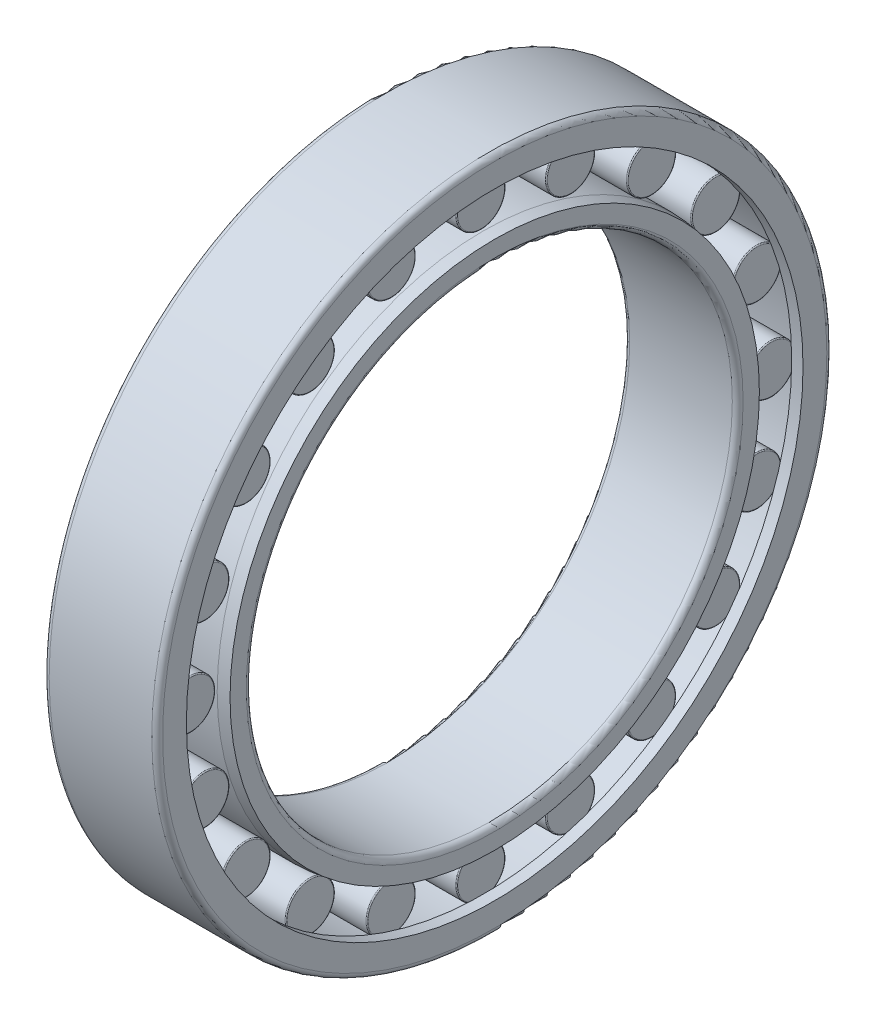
SolidWorks part; units mm, degrees
ref_plane "Plane1" through (0, 0, 0) normal (0, 0, 1) x (1, 0, 0)
ref_plane "Plane2" through (0, 0, 0) normal (0, 1, 0) x (1, 0, 0)
ref_plane "Plane3" through (0, 0, 0) normal (1, 0, 0) x (0, 0, -1)
sketch "Clipboard" plane through (0, 0, 0) normal (0, 0, 1) x (1, 0, 0)
  line L0 (-10, 0) -> (10, 0) construction
  line L1 (0, 0) -> (185.2698, -67.4327)
  line L2 (0, 0) -> (101.017, 36.7672)
  line L3 (0, 0) -> (218.798, -79.636)
  line L4 (0, 0) -> (-22.3471, -0.7804)
  dimension "CLdia" = 107.5
  dimension "Count" = 20
  dimension "Show_count" = 20
  dimension "Max_count" = 20
  dimension "Min_count" = 2
  dimension "Race_OD" = 232.84
  dimension "Race_ID" = 197.16
sketch "OutRacSke" plane through (0, 0, 0) normal (0, 0, 1) x (1, 0, 0)
  line L0 (-16.8, 114.1887) -> (-21, 114.1887)
  line L1 (-21, 114.1887) -> (-21, 123)
  line L2 (-19, 125) -> (19, 125)
  line L3 (21, 123) -> (21, 114.1888)
  line L4 (21, 114.1888) -> (16.8, 114.1888)
  line L5 (16.8, 114.1888) -> (16.8, 116.42)
  line L6 (16.8, 116.42) -> (-16.8, 116.42)
  line L7 (-16.8, 116.42) -> (-16.8, 114.1887)
  line L8 (-90, 0) -> (90, 0) construction
  arc A0 (-21, 123) -> (-19, 125) centre (-19, 123) cw
  arc A1 (19, 125) -> (21, 123) centre (19, 123) cw
  dimension "radius" = 2
  dimension "Race_OD" = 232.84
  dimension "OD" = 250
  dimension "Cyl_Len" = 33.6
  dimension "halfCylLen" = 16.8
  dimension "Width" = 42
  dimension "halfWidth" = 21
  dimension "groove_dp" = 2.2313
revolve "OuterRace" add sketch "OutRacSke" angle 360 about L8
sketch "RolDetSke" plane through (0, 0, 0) normal (0, 0, 1) x (1, 0, 0)
  line L0 (-15.96, 116.1851) -> (-15.96, 107.5)
  line L1 (-15.96, 107.5) -> (15.96, 107.5)
  line L2 (15.96, 107.5) -> (15.96, 116.1851)
  line L3 (15.5981, 116.547) -> (-15.5981, 116.547)
  line L4 (-33.6, 107.5) -> (33.6, 107.5) construction
  arc A0 (15.96, 116.1851) -> (15.5981, 116.547) centre (15.5981, 116.1851) ccw
  arc A1 (-15.5981, 116.547) -> (-15.96, 116.1851) centre (-15.5981, 116.1851) ccw
  dimension "radius" = 0.3619
  dimension "RolCLRad" = 107.5
  dimension "Length" = 31.92
  dimension "halfLength" = 15.96
  dimension "Roller_diameter" = 18.094
revolve "RollerDetailed" add sketch "RolDetSke" angle 360 about L4
ref_axis "Axis1" through (-50, 0, 0) along (1, 0, 0)
sketch "RolSimSke" plane through (0, 101.6, 0) normal (0, 0, 1) x (1, 0, 0)
  line L0 (-15.96, 14.5851) -> (-15.96, -2.7851)
  line L1 (25.4, -101.6) -> (-25.4, -101.6) construction
  line L2 (15.96, -2.7851) -> (15.96, 14.5851)
  line L3 (15.5981, 14.947) -> (-15.5981, 14.947)
  line L5 (15.5981, -3.147) -> (-15.5981, -3.147)
  arc A0 (15.96, 14.5851) -> (15.5981, 14.947) centre (15.5981, 14.5851) ccw
  arc A1 (-15.5981, 14.947) -> (-15.96, 14.5851) centre (-15.5981, 14.5851) ccw
  arc A2 (15.96, -2.7851) -> (15.5981, -3.147) centre (15.5981, -2.7851) cw
  arc A3 (-15.5981, -3.147) -> (-15.96, -2.7851) centre (-15.5981, -2.7851) cw
  dimension "radius" = 0.3619
  dimension "D1" = 98.453
  dimension "Roller_diameter" = 18.094
  dimension "Rol_Length" = 31.92
  dimension "halfLength" = 15.96
revolve "RollersSimplified" [suppressed] add sketch "RolSimSke" angle 360 about L1
sketch "InsRacSke" plane through (0, 0, 0) normal (0, 0, 1) x (1, 0, 0)
  line L0 (-16.8, 98.58) -> (-21, 98.0222)
  line L1 (-21, 98.0222) -> (-21, 92)
  line L2 (-19, 90) -> (19, 90)
  line L3 (21, 92) -> (21, 98.0222)
  line L4 (21, 98.0222) -> (16.8, 98.58)
  line L5 (16.8, 98.58) -> (-16.8, 98.58)
  line L6 (-90, 0) -> (90, 0) construction
  arc A0 (-21, 92) -> (-19, 90) centre (-19, 92) ccw
  arc A1 (19, 90) -> (21, 92) centre (19, 92) ccw
  dimension "radius" = 2
  dimension "Bore" = 180
  dimension "Race_ID" = 197.16
  dimension "Width" = 42
  dimension "halfWidth" = 21
  dimension "groove_dp" = 0.5578
  dimension "Cyl_Len" = 33.6
revolve "InnerRace" add sketch "InsRacSke" angle 360 about L6
pattern_circular "RollersDetailed" count 20 every 18 about axis through (-50, 0, 0) along (1, 0, 0) of "RollerDetailed"
sketch "CagSpiSke" plane through (0, 0, 0) normal (0, 0, 1) x (1, 0, 0)
  line L0 (18.9, 105.2383) -> (18.9, 109.7618)
  line L1 (18.9, 109.7618) -> (-18.9, 109.7618)
  line L2 (-18.9, 109.7618) -> (-18.9, 105.2383)
  line L3 (-18.9, 105.2383) -> (18.9, 105.2383)
  line L4 (-90, 0) -> (90, 0) construction
  dimension "Cag_IR" = 210.4765
  dimension "thickness" = 4.5235
  dimension "width" = 37.8
  dimension "halfwidth" = 18.9
revolve "CageSpine" [suppressed] add sketch "CagSpiSke" angle 360 about L4
equation "\"CLdia@Clipboard\" =  ( \"Race_OD@Clipboard\" + \"Race_ID@Clipboard\" )  / 4"
equation "\"Race_OD@OutRacSke\" = \"Race_OD@Clipboard\""
equation "\"halfCylLen@OutRacSke\" = \"Cyl_Len@OutRacSke\" / 2"
equation "\"RolCLRad@RolDetSke\" = \"CLdia@Clipboard\""
equation "\"Roller_diameter@RolDetSke\" =  ( \"Race_OD@Clipboard\" - \"Race_ID@Clipboard\" )  / 2 + .01"
equation "\"Roller_diameter@RolSimSke\" =  ( \"Race_OD@Clipboard\" - \"Race_ID@Clipboard\" )  / 2 + .01"
equation "\"radius@RolDetSke\" = \"Roller_diameter@RolDetSke\" / 50"
equation "\"Length@RolDetSke\" = \"Cyl_Len@OutRacSke\" * .95"
equation "\"halfLength@RolDetSke\" = \"Length@RolDetSke\" / 2"
equation "\"thickness@CagSpiSke\"  = \"Roller_diameter@RolDetSke\" * .25"
equation "\"Cag_IR@CagSpiSke\" =  \"RolCLRad@RolDetSke\" * 2 - \"thickness@CagSpiSke\""
equation "\"Rol_length@RolSimSke\" = \"Cyl_Len@InsRacSke\" * .95"
equation "\"halfLength@RolSimSke\" = \"Rol_length@RolSimSke\" / 2"
equation "\"radius@RolSimSke\" = \"radius@RolDetSke\""
equation "\"D1@RolSimSke\" = \"CLdia@Clipboard\" -  ( \"Roller_diameter@RolSimSke\" / 2 ) "
equation "\"Max_count@Clipboard\" = int( 3.14159265 / atn(( \"Roller_diameter@RolDetSke\" / 2) / sqr( \"RolCLRad@RolDetSke\"  *  \"RolCLRad@RolDetSke\" - ( \"Roller_diameter@RolDetSke\" / 2) *  ( \"Roller_diameter@RolDetS"
equation "\"Max_count@Clipboard\" = ((sgn( \"Max_count@Clipboard\" - \"Count@Clipboard\" )-1)*( \"Max_count@Clipboard\" - \"Count@Clipboard\" ))/-2+ \"Count@Clipboard\""
equation "\"Count@RollersDetailed\" = int( \"Show_count@Clipboard\" ) "
equation "\"Count@RollersDetailed\" = ((sgn( \"Count@RollersDetailed\" - \"Max_count@Clipboard\" )-1)*( \"Count@RollersDetailed\" - \"Max_count@Clipboard\" ))/-2+ \"Max_count@Clipboard\""
equation "\"Count@RollersDetailed\" = ((sgn( \"Count@RollersDetailed\" - \"Min_count@Clipboard\" )+1)*( \"Count@RollersDetailed\" - \"Min_count@Clipboard\"))/2 +\"Min_count@Clipboard\""
equation "\"Angle@RollersDetailed\" = 360.0 / \"Max_count@Clipboard\""
equation "\"radius@InsRacSke\" = \"radius@OutRacSke\""
equation "\"groove_dp@InsRacSke\" = \"groove_dp@OutRacSke\" / 4"
equation "\"Width@InsRacSke\" = \"Width@OutRacSke\""
equation "\"halfWidth@OutRacSke\" = \"Width@OutRacSke\" / 2"
equation "\"halfWidth@InsRacSke\" = \"Width@InsRacSke\" / 2"
equation "\"Race_ID@InsRacSke\" = \"Race_ID@Clipboard\""
equation "\"Cyl_Len@InsRacSke\" = \"Cyl_Len@OutRacSke\""
equation "\"Angle@CageSpine\" =  \"Angle@RollersDetailed\" * ( \"Count@RollersDetailed\" -1 + int( \"Count@RollersDetailed\" / \"Max_count@Clipboard\" ) )  + 0.001 -  int( \"Count@RollersDetailed\" / \"Max_count@Clipboard\" "
equation "\"Angle@CageSpine\" =  \"Angle@CageSpine\" * int( \"Min_count@Clipboard\" / 2) + int(1 / \"Min_count@Clipboard\")  * 0.001"
equation "\"width@CagSpiSke\" =   ( \"Width@InsRacSke\" + \"Cyl_Len@InsRacSke\" )  / 2"
equation "\"halfwidth@CagSpiSke\" = \"width@CagSpiSke\" / 2"
